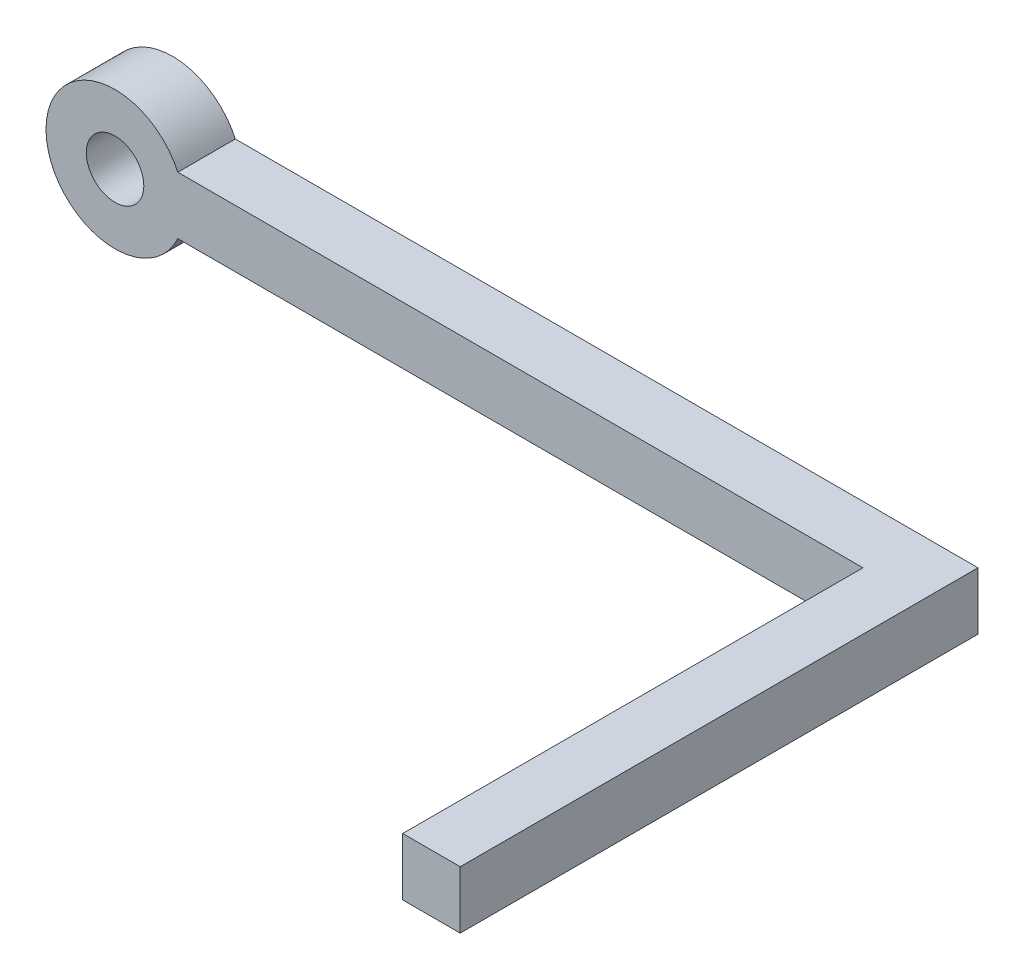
SolidWorks part; units mm, degrees
ref_plane "Front Plane" through (0, 0, 0) normal (0, 0, 1) x (1, 0, 0)
ref_plane "Top Plane" through (0, 0, 0) normal (0, 1, 0) x (1, 0, 0)
ref_plane "Right Plane" through (0, 0, 0) normal (1, 0, 0) x (0, 0, -1)
sketch "Sketch3" plane through (0, 0, 0) normal (0, 0, 1) x (1, 0, 0)
  circle A0 centre (0, 0) radius 3.81
extrude "Boss-Extrude2" add sketch "Sketch3" along normal blind 3.175
sketch "Sketch5" plane through (0, 0, 3.175) normal (0, 0, 1) x (1, 0, 0)
  line L0 (0, 0) -> (0, 1.5875)
  line L1 (0, 1.5875) -> (44.45, 1.5875)
  line L2 (0, 0) -> (0, -1.5875)
  line L3 (0, -1.5875) -> (44.45, -1.5875)
  line L4 (44.45, -1.5875) -> (44.45, 1.5875)
extrude "Boss-Extrude3" add sketch "Sketch5" against normal blind 3.175
sketch "Sketch6" plane through (0, 0, 3.175) normal (0, 0, 1) x (1, 0, 0)
  circle A0 centre (0, 0) radius 1.5875
extrude "Cut-Extrude1" cut sketch "Sketch6" against normal blind 3.175
sketch "Sketch8" plane through (0, 0, 3.175) normal (0, 0, 1) x (1, 0, 0)
  line L0 (44.45, 1.5875) -> (41.275, 1.5875)
  line L1 (44.45, 1.5875) -> (3.4635, 1.5875) construction
  line L2 (41.275, 1.5875) -> (41.275, -1.5875)
  line L3 (3.4635, -1.5875) -> (44.45, -1.5875) construction
  line L4 (41.275, -1.5875) -> (44.45, -1.5875)
  line L5 (44.45, -1.5875) -> (44.45, 1.5875)
extrude "Boss-Extrude5" add sketch "Sketch8" along normal blind 25.4
